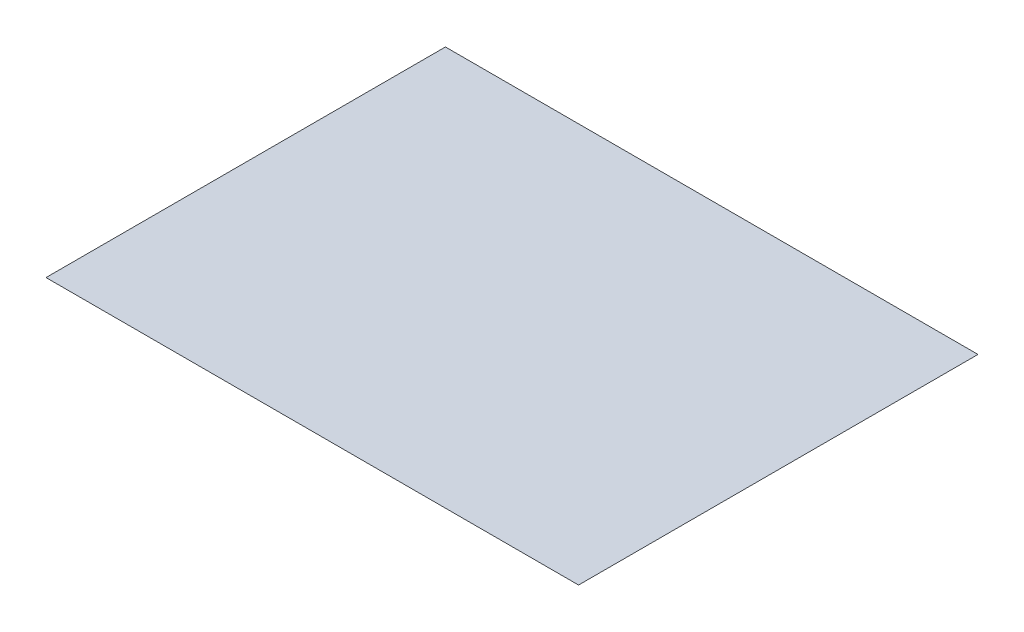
SolidWorks part; units mm, degrees
ref_plane "Y" through (0, 0, 0) normal (0, 0, 1) x (1, 0, 0)
ref_plane "Z" through (0, 0, 0) normal (0, 1, 0) x (1, 0, 0)
ref_plane "X" through (0, 0, 0) normal (1, 0, 0) x (0, 0, -1)
sketch "Skizze1" plane through (0, 0, 0) normal (0, 1, 0) x (1, 0, 0)
  line L1 (-100000, 75000) -> (100000, 75000)
  line L2 (-100000, 75000) -> (-100000, -75000)
  line L3 (-100000, -75000) -> (100000, -75000)
  line L4 (100000, 75000) -> (100000, -75000)
  point P4 (0, 75000)
  point P6 (-100000, 0)
  dimension "D1" = 200000
  dimension "D2" = 150000
surface "Oberfläche-Ebene1" sketch "Skizze1"
